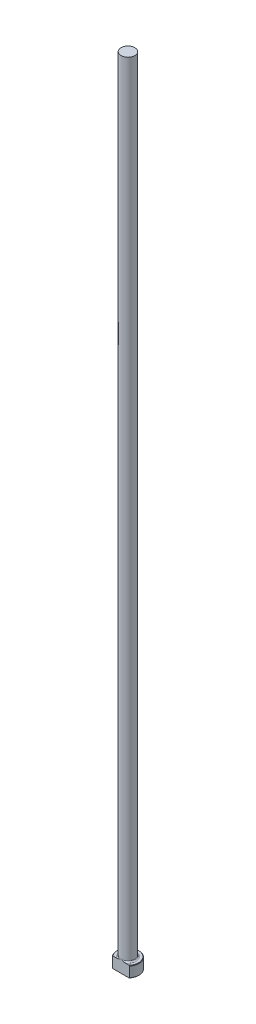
SolidWorks part; units mm, degrees
ref_plane "Front Plane" through (0, 0, 0) normal (0, 0, 1) x (1, 0, 0)
ref_plane "Top Plane" through (0, 0, 0) normal (0, 1, 0) x (1, 0, 0)
ref_plane "Right Plane" through (0, 0, 0) normal (1, 0, 0) x (0, 0, -1)
sketch "Sketch1" plane through (0, 0, 0) normal (0, 0, 1) x (1, 0, 0)
  line L0 (0, 259.9588) -> (0, -15.1925) construction
  line L1 (0, 0) -> (-6.35, 0)
  line L2 (-6.35, 0) -> (-6.35, 6.35)
  line L3 (-6.35, 6.35) -> (-3.9687, 6.35)
  line L4 (-3.9687, 6.35) -> (-3.9687, 457.2)
  line L5 (-3.9687, 457.2) -> (0, 457.2)
  line L6 (0, 457.2) -> (0, 0)
  dimension "L" = 457.2
  dimension "H" = 12.7
  dimension "T" = 6.35
  dimension "D" = 7.9375
revolve "Revolve1" add sketch "Sketch1" angle 360 about L0
chamfer "Chamfer1" distance 0.254 angle 45 2 edges at (0, 6.35, 6.35) (0, 0, 6.35)
fillet "Fillet1" radius 0.762 1 edges at (0, 6.35, 3.9687)
sketch "Sketch2" plane through (0, 0, 0) normal (0, 1, 0) x (1, 0, 0)
  line L0 (-4.957, -3.9687) -> (4.957, -3.9687)
  circle A0 centre (0, 0) radius 6.35 construction
  arc A1 (-4.957, -3.9687) -> (4.957, -3.9687) centre (0, 0) ccw
  circle A3 centre (0, 0) radius 3.9687 construction
  dimension "D1" = 0
extrude "Key" cut sketch "Sketch2" along normal through all
sketch "Pocket Sketch" plane through (0, 0, 0) normal (0, 0, 1) x (1, 0, 0)
  line L0 (-6.7469, 0) -> (-6.7469, 6.3754)
  line L1 (-6.7469, 6.3754) -> (-5.1276, 6.3754)
  line L2 (-4.3656, 7.1374) -> (-4.3656, 22.225)
  line L3 (-4.3656, 22.225) -> (0, 22.225)
  line L4 (0, 22.225) -> (0, 0)
  line L5 (0, 0) -> (-6.7469, 0)
  line L6 (0, 12.6104) -> (0, -2.4989) construction
  line L7 (-6.35, 6.096) -> (-6.35, 0.254) construction
  line L8 (6.096, 6.35) -> (-6.096, 6.35) construction
  line L9 (-3.9687, 457.2) -> (-3.9687, 7.112) construction
  line L10 (-5.1276, 6.3754) -> (-4.3656, 7.1374)
  point P3 (-4.3656, 6.3754)
  dimension "D1" = 13.4937
  dimension "D2" = 0.3969
  dimension "D3" = 0.0254
  dimension "D4" = 0.3969
  dimension "D5" = 8.7312
  dimension "D6" = 22.225
